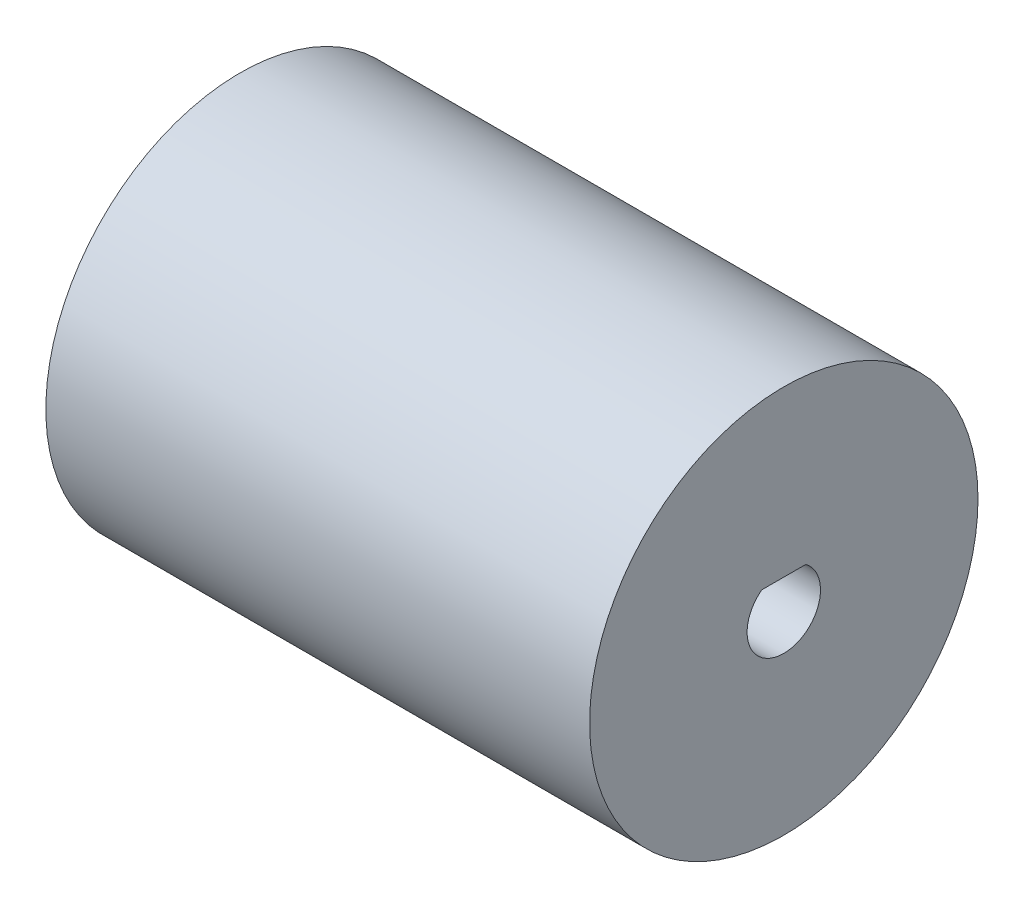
SolidWorks part; units mm, degrees
ref_plane "Front" through (0, 0, 0) normal (0, 0, 1) x (1, 0, 0)
ref_plane "Top" through (0, 0, 0) normal (0, 1, 0) x (1, 0, 0)
ref_plane "Right" through (0, 0, 0) normal (1, 0, 0) x (0, 0, -1)
sketch "Sketch1" plane through (0, 0, 0) normal (1, 0, 0) x (0, 0, -1)
  circle A0 centre (0, 0) radius 7.9375
  dimension "D1" = 15.875
extrude "Extrude1" add sketch "Sketch1" along normal blind 22.225
sketch "Sketch3" plane through (22.225, 0, 0) normal (1, 0, 0) x (0, 0, -1)
  line L0 (0, -1.5) -> (0, 1.2) construction
  line L1 (-0.9, 1.2) -> (0.9, 1.2)
  arc A0 (-0.9, 1.2) -> (0.9, 1.2) centre (0, 0) ccw
  dimension "D1" = 3
  dimension "D2" = 2.7
extrude "Extrude2" cut sketch "Sketch3" against normal blind 11.1125
sketch "Sketch6" plane through (0, 0, 0) normal (-1, 0, 0) x (0, 0, 1)
  line L0 (0, -3.175) -> (0, 2.54) construction
  line L1 (-1.905, 2.54) -> (1.905, 2.54)
  arc A0 (-1.905, 2.54) -> (1.905, 2.54) centre (0, 0) ccw
  dimension "D1" = 3.175
  dimension "D2" = 5.715
extrude "Extrude3" cut sketch "Sketch6" against normal blind 11.1125
